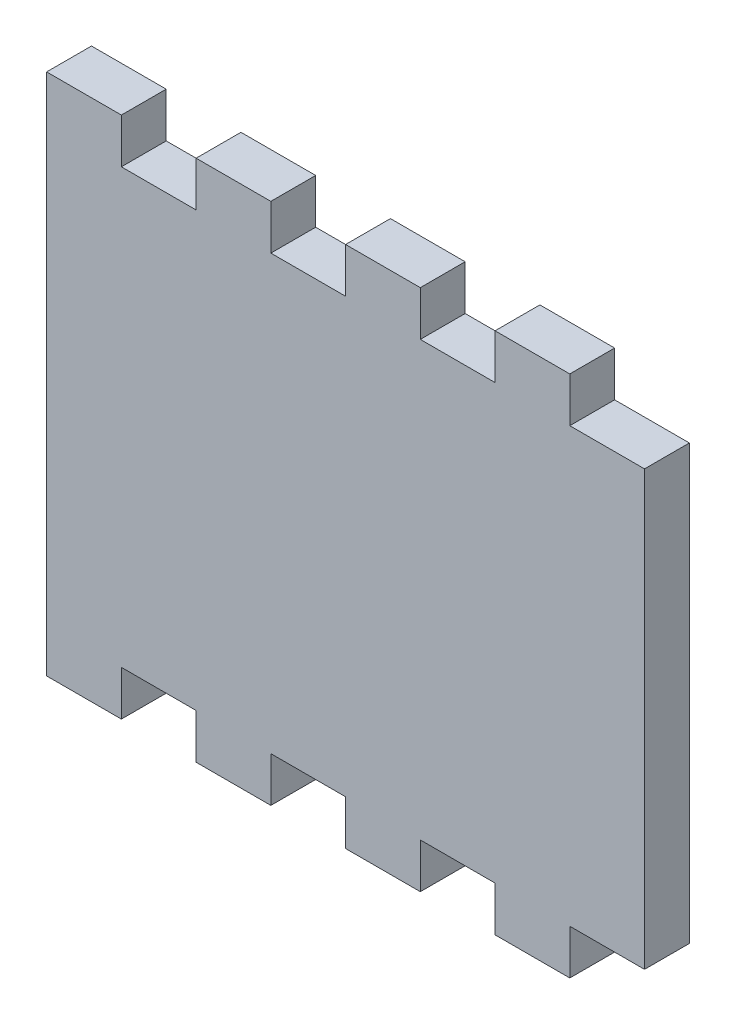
SolidWorks part; units mm, degrees
ref_plane "Piano frontale" through (0, 0, 0) normal (0, 0, 1) x (1, 0, 0)
ref_plane "Piano superiore" through (0, 0, 0) normal (0, 1, 0) x (1, 0, 0)
ref_plane "Piano destro" through (0, 0, 0) normal (1, 0, 0) x (0, 0, -1)
sketch "Schizzo1" plane through (0, 0, 0) normal (0, 0, 1) x (1, 0, 0)
  line L0 (-20, 35) -> (-20, 29)
  line L1 (-40, 35) -> (-30, 35)
  line L2 (-40, 35) -> (-40, -35)
  line L3 (-40, -35) -> (-30, -35)
  line L4 (40, 29) -> (40, -29)
  line L5 (0, 35) -> (10, 35)
  line L6 (-30, 35) -> (-30, 29)
  line L7 (-30, 29) -> (-20, 29)
  line L8 (-20, 35) -> (-20, 29)
  line L9 (-10, 35) -> (-10, 29)
  line L10 (-20, 29) -> (-10, 29)
  line L11 (-10, 35) -> (-10, 29)
  line L12 (0, 35) -> (0, 29)
  line L13 (-10, 29) -> (0, 29)
  line L14 (0, 35) -> (0, 29)
  line L15 (10, 35) -> (10, 29)
  line L16 (0, 29) -> (10, 29)
  line L17 (10, 35) -> (10, 29)
  line L18 (20, 35) -> (20, 29)
  line L19 (10, 29) -> (20, 29)
  line L20 (20, 35) -> (20, 29)
  line L21 (30, 35) -> (30, 29)
  line L22 (20, 29) -> (30, 29)
  line L23 (30, 35) -> (30, 29)
  line L24 (-40, 0) -> (40, 0) construction
  line L25 (30, 29) -> (40, 29)
  line L26 (-20, 35) -> (-10, 35)
  line L27 (20, 35) -> (30, 35)
  line L28 (40, 35) -> (40, 29)
  line L29 (30, -29) -> (40, -29)
  line L30 (30, -35) -> (30, -29)
  line L31 (20, -35) -> (20, -29)
  line L32 (10, -29) -> (20, -29)
  line L33 (10, -35) -> (10, -29)
  line L34 (0, -35) -> (0, -29)
  line L35 (-10, -29) -> (0, -29)
  line L36 (-10, -35) -> (-10, -29)
  line L37 (-20, -35) -> (-20, -29)
  line L38 (-30, -29) -> (-20, -29)
  line L39 (-30, -35) -> (-30, -29)
  line L40 (-20, -35) -> (-10, -35)
  line L41 (0, -35) -> (10, -35)
  line L42 (20, -35) -> (30, -35)
  dimension "D1" = 70
  dimension "D3" = 10
  dimension "D4" = 6
  dimension "D5" = 7
extrude "Estrusione-Estrusione1" add sketch "Schizzo1" along normal blind 6
